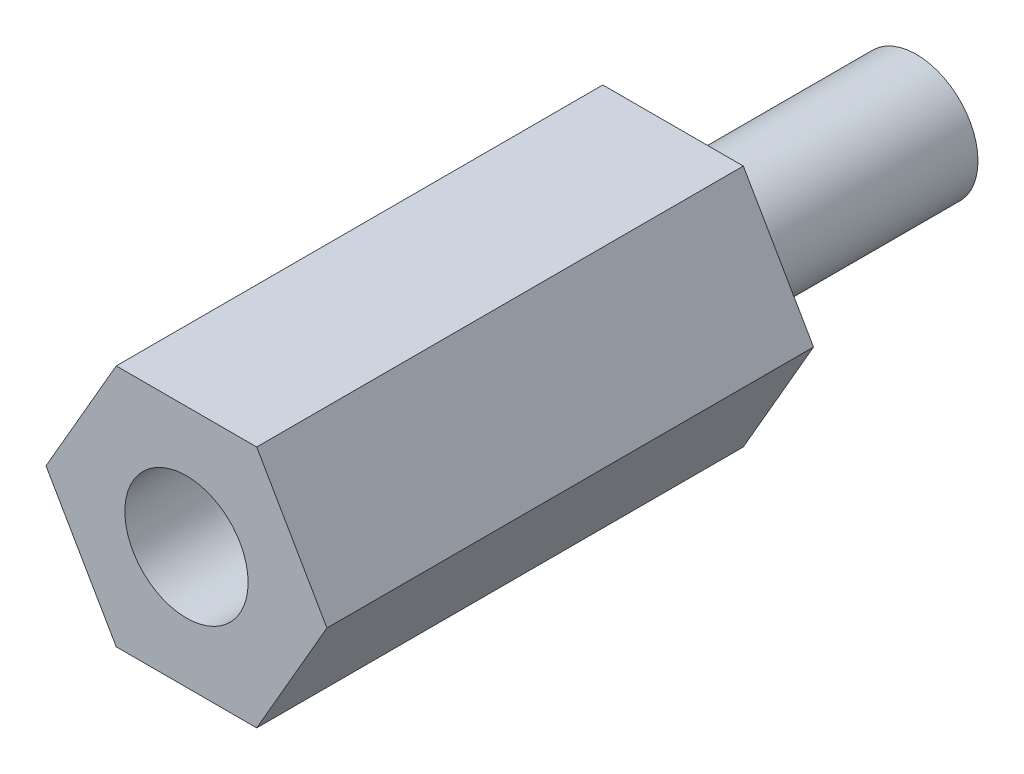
SolidWorks part; units mm, degrees
ref_plane "Front Plane" through (0, 0, 0) normal (0, 0, 1) x (1, 0, 0)
ref_plane "Top Plane" through (0, 0, 0) normal (0, 1, 0) x (1, 0, 0)
ref_plane "Right Plane" through (0, 0, 0) normal (1, 0, 0) x (0, 0, -1)
sketch "Sketch1" plane through (0, 0, 0) normal (0, 0, 1) x (1, 0, 0)
  line L1 (-2.7496, -4.7625) -> (2.7496, -4.7625)
  line L2 (2.7496, -4.7625) -> (5.4993, 0)
  line L3 (5.4993, 0) -> (2.7496, 4.7625)
  line L4 (2.7496, 4.7625) -> (-2.7496, 4.7625)
  line L5 (-2.7496, 4.7625) -> (-5.4993, 0)
  line L6 (-5.4993, 0) -> (-2.7496, -4.7625)
  circle A0 centre (0, 0) radius 4.7625 construction
  dimension "D1" = 9.525
extrude "Boss-Extrude1" add sketch "Sketch1" along normal blind 19.05
sketch "Sketch2" plane through (0, 0, 0) normal (0, 0, -1) x (-1, 0, 0)
  circle A0 centre (0, 0) radius 2.413
  dimension "D1" = 4.826
extrude "Boss-Extrude2" add sketch "Sketch2" along normal blind 9.525
sketch "Sketch3" plane through (0, 0, 19.05) normal (0, 0, 1) x (1, 0, 0)
  circle A0 centre (0, 0) radius 2.413
  dimension "D1" = 4.826
extrude "Cut-Extrude1" cut sketch "Sketch3" against normal blind 9.525
